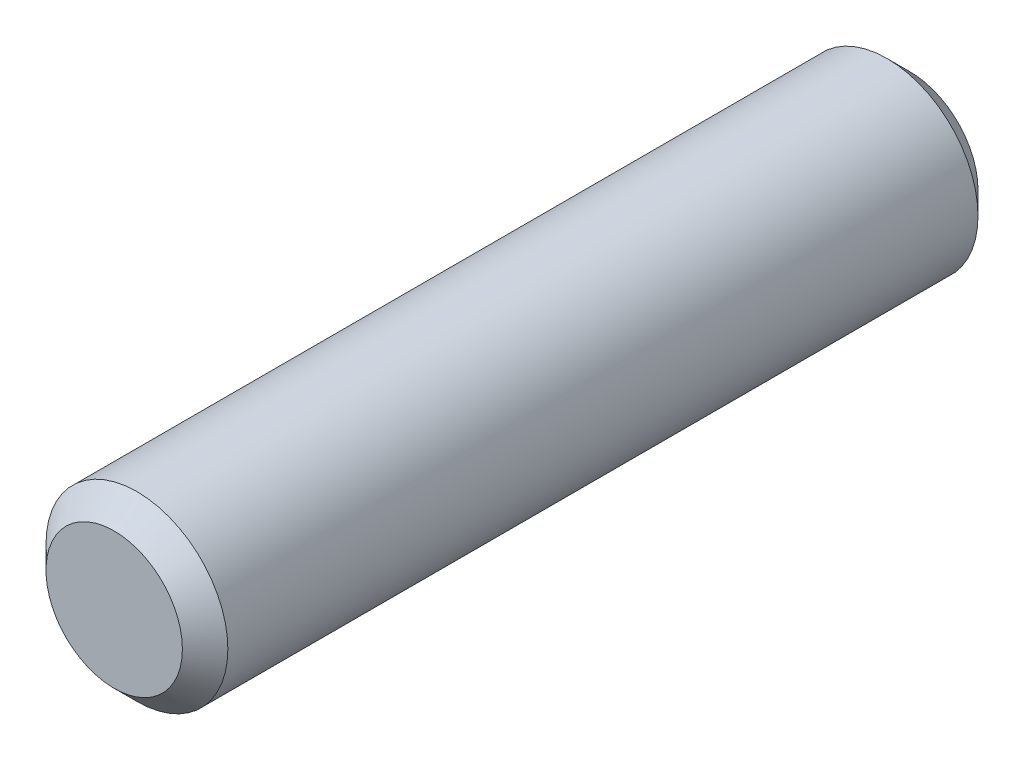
SolidWorks part; units mm, degrees
ref_plane "Plan de face" through (0, 0, 0) normal (0, 0, 1) x (1, 0, 0)
ref_plane "Plan de dessus" through (0, 0, 0) normal (0, 1, 0) x (1, 0, 0)
ref_plane "Plan de droite" through (0, 0, 0) normal (1, 0, 0) x (0, 0, -1)
sketch "Esquisse1" plane through (0, 0, 0) normal (0, 0, 1) x (1, 0, 0)
  circle A0 centre (0, 0) radius 4
  dimension "D1" = 8
extrude "Boss.-Extru.1" add sketch "Esquisse1" along normal blind 35
chamfer "Chanfrein1" distance 1 angle 45 2 edges at (4, 0, 0) (4, 0, 35)
